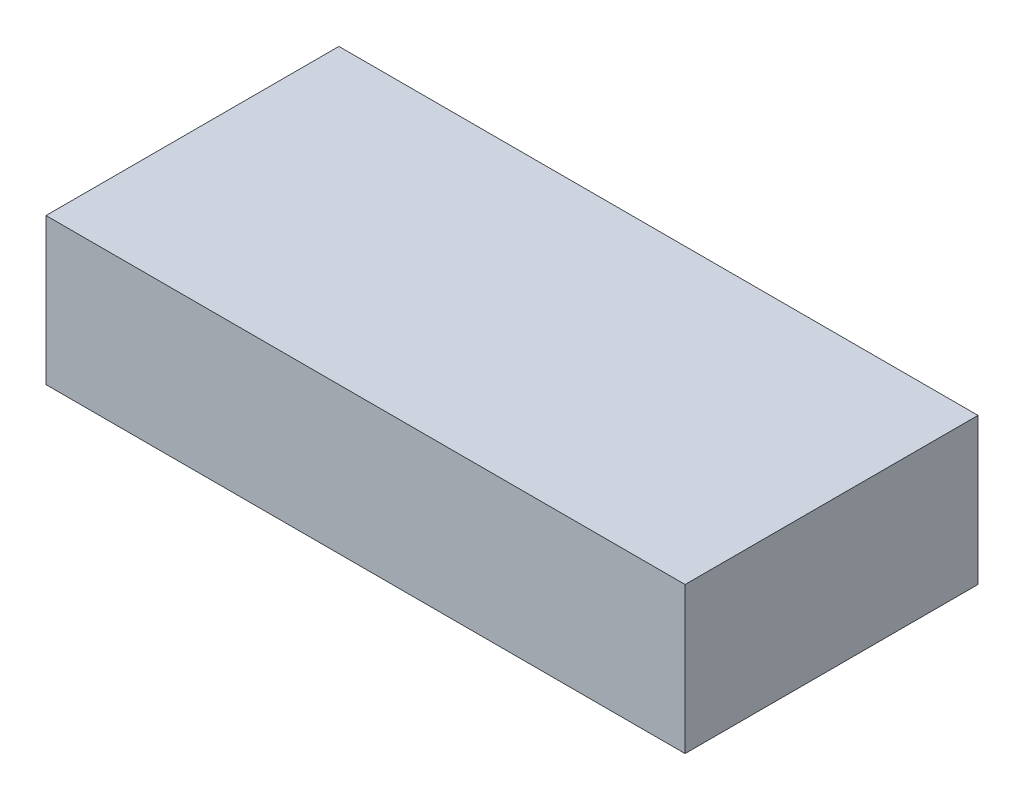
SolidWorks part; units mm, degrees
ref_plane "Plan de face" through (0, 0, 0) normal (0, 0, 1) x (1, 0, 0)
ref_plane "Plan de dessus" through (0, 0, 0) normal (0, 1, 0) x (1, 0, 0)
ref_plane "Plan de droite" through (0, 0, 0) normal (1, 0, 0) x (0, 0, -1)
sketch "Esquisse1" plane through (0, 0, 0) normal (0, 0, 1) x (1, 0, 0)
  line L1 (0, 0) -> (240, 0)
  line L2 (0, 0) -> (0, 55)
  line L3 (0, 55) -> (240, 55)
  line L4 (240, 0) -> (240, 55)
  dimension "D1" = 240
  dimension "D2" = 55
extrude "Boss.-Extru.1" add sketch "Esquisse1" along normal blind 110
